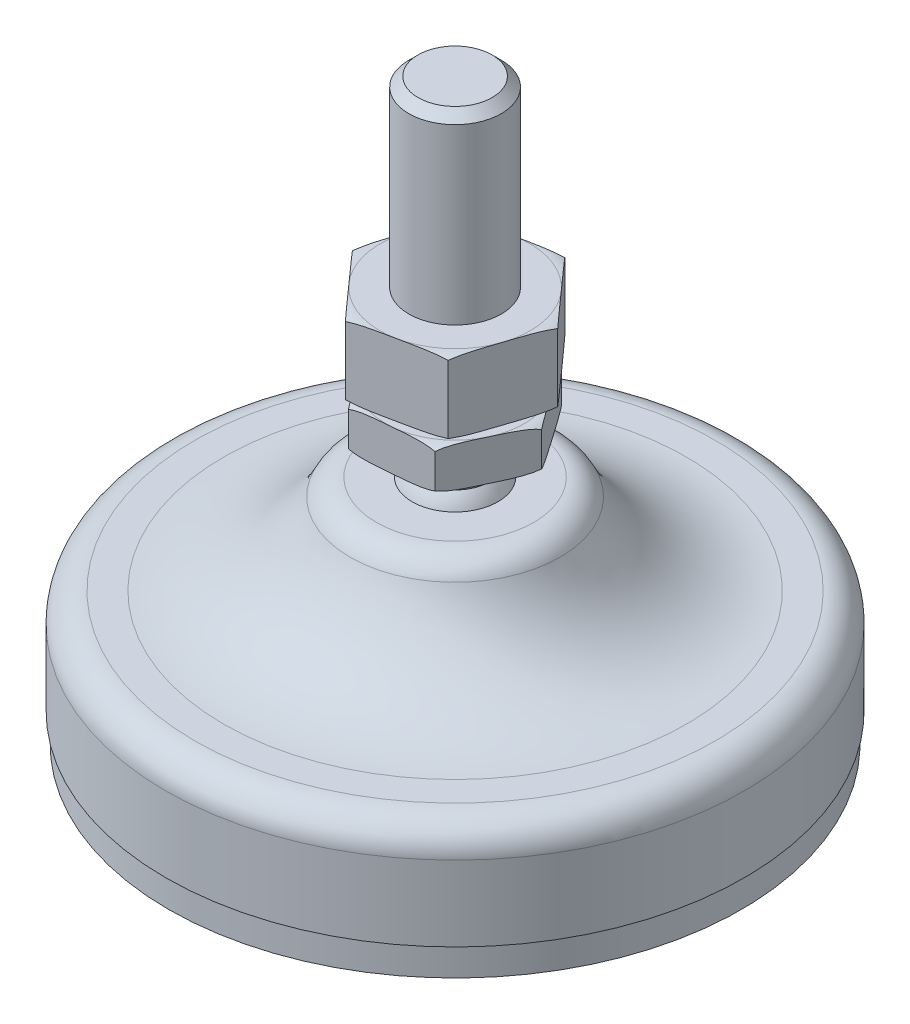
SolidWorks part; units mm, degrees
ref_plane "Plan de face" through (0, 0, 0) normal (0, 0, 1) x (1, 0, 0)
ref_plane "Plan de dessus" through (0, 0, 0) normal (0, 1, 0) x (1, 0, 0)
ref_plane "Plan de droite" through (0, 0, 0) normal (1, 0, 0) x (0, 0, -1)
sketch "Esquisse1" plane through (0, 0, 0) normal (0, 0, 1) x (1, 0, 0)
  line L0 (0, -34.5133) -> (0, -50)
  line L2 (0, -50) -> (-24.75, -50)
  line L3 (-24.75, -50) -> (-24.75, -47.5)
  line L4 (-24.75, -47.5) -> (-25, -47.5)
  line L5 (-25, -47.5) -> (-25, -41)
  line L6 (-22.5, -38.5) -> (-20, -38.5)
  line L7 (-3, -28.8542) -> (-3, -26.5)
  line L8 (-6.7996, -30) -> (-3.7081, -30)
  line L10 (-4, -23) -> (-4, -22)
  line L11 (-4, -22) -> (-6.5, -22)
  line L12 (-6.5, -22) -> (-6.5, -15.8) construction
  line L13 (-6.5, -15.8) -> (-4, -15.8)
  line L15 (-4, -15.8) -> (-4, -0.8)
  line L16 (-4, -0.8) -> (-3.2, 0)
  line L17 (-3.2, 0) -> (0, 0)
  line L18 (0, 0) -> (0, -34.5133)
  line L20 (-3, -26.5) -> (-6, -26.5)
  line L21 (-6, -26.5) -> (-6, -23) construction
  line L22 (-6, -23) -> (-4, -23)
  arc A0 (-20, -38.5) -> (-9.0755, -31.4655) centre (-20, -26.5) ccw
  arc A1 (-3, -28.8542) -> (-3.7081, -30) centre (0, -31.5) ccw
  arc A2 (-9.0755, -31.4655) -> (-6.7996, -30) centre (-6.7996, -32.5) cw
  arc A3 (-25, -41) -> (-22.5, -38.5) centre (-22.5, -41) cw
  arc A4 (-6, -23) -> (-6, -26.5) centre (-6, -24.75) ccw
  arc A5 (-6.5, -15.8) -> (-6.5, -22) centre (-6.5, -18.9) ccw
  point P30 (-25, -38.5)
  dimension "D5" = 8
  dimension "D7" = 12
  dimension "D11" = 2.5
  dimension "D12" = 2.5
  dimension "D18" = 6
  dimension "D1" = 2.5
  dimension "D2" = 0.25
  dimension "D3" = 20
  dimension "D4" = 25
  dimension "D6" = 4
  dimension "D8" = 9
  dimension "D9" = 7
  dimension "D10" = 5
  dimension "D13" = 3
  dimension "D14" = 27
  dimension "D15" = 6.5
  dimension "D16" = 3.5
  dimension "D17" = 1
  dimension "D20" = 6.2
  dimension "D21" = 50
  dimension "D22" = 0.8
  dimension "D23" = 45
revolve "Révolution1" add sketch "Esquisse1" angle 360 about L18
sketch "Esquisse2" plane through (0, -15.8, 0) normal (0, 1, 0) x (1, 0, 0)
  line L1 (-7.3495, -1.5225) -> (-2.3562, -7.1261)
  line L2 (-2.3562, -7.1261) -> (4.9933, -5.6036)
  line L3 (4.9933, -5.6036) -> (7.3495, 1.5225)
  line L4 (7.3495, 1.5225) -> (2.3562, 7.1261)
  line L5 (2.3562, 7.1261) -> (-4.9933, 5.6036)
  line L6 (-4.9933, 5.6036) -> (-7.3495, -1.5225)
  circle A0 centre (0, 0) radius 6.5 construction
  circle A1 centre (0, 0) radius 47.6821
  dimension "D1" = 13
extrude "Enlèv. mat.-Extru.1" cut sketch "Esquisse2" against normal blind 8
sketch "Esquisse3" plane through (0, -23, 0) normal (0, 1, 0) x (1, 0, 0)
  line L1 (-3.9548, 5.6885) -> (-6.9038, -0.5807)
  line L2 (-6.9038, -0.5807) -> (-2.949, -6.2692)
  line L3 (-2.949, -6.2692) -> (3.9548, -5.6885)
  line L4 (3.9548, -5.6885) -> (6.9038, 0.5807)
  line L5 (6.9038, 0.5807) -> (2.949, 6.2692)
  line L6 (2.949, 6.2692) -> (-3.9548, 5.6885)
  circle A0 centre (0, 0) radius 6 construction
  circle A1 centre (0, 0) radius 14.2827
  dimension "D1" = 12
extrude "Enlèv. mat.-Extru.2" cut sketch "Esquisse3" against normal blind 4
